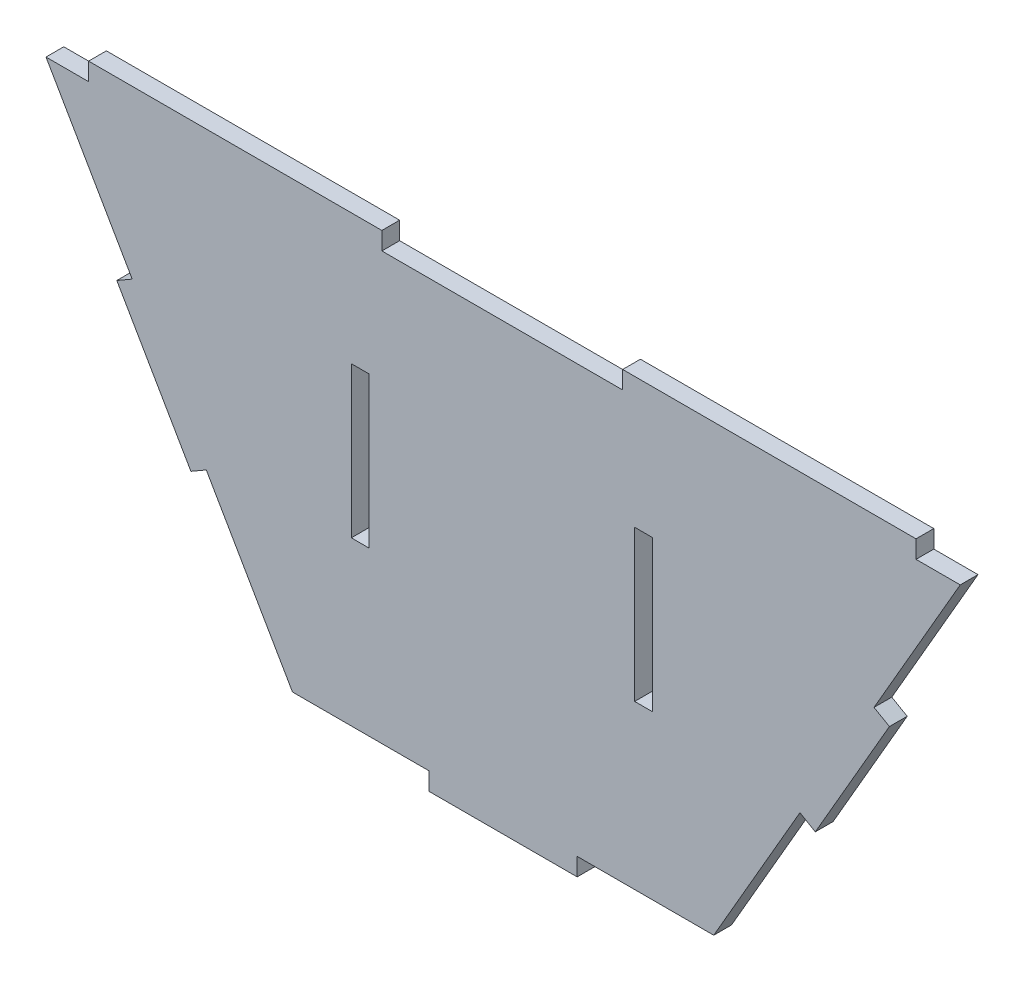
SolidWorks part; units mm, degrees
ref_plane "Front Plane" through (0, 0, 0) normal (0, 0, 1) x (1, 0, 0)
ref_plane "Top Plane" through (0, 0, 0) normal (0, 1, 0) x (1, 0, 0)
ref_plane "Right Plane" through (0, 0, 0) normal (1, 0, 0) x (0, 0, -1)
sketch "Sketch1" plane through (0, 0, 0) normal (0, 0, 1) x (1, 0, 0)
  line L0 (-35.5427, 0) -> (-35.5427, 1.524)
  line L1 (-35.5427, 1.524) -> (-10.3967, 1.524)
  line L2 (-39.1955, 0) -> (-31.8042, -12.7942)
  line L4 (-35.5427, 0) -> (-39.1955, 0)
  line L5 (-13.0154, -22.6139) -> (-11.4914, -22.6139)
  line L6 (-10.3967, 1.524) -> (-10.3967, 0)
  line L7 (-10.3967, 0) -> (10.2512, 0)
  line L8 (10.2512, 0) -> (10.2512, 1.524)
  line L9 (-13.0154, -22.6139) -> (-13.0154, -9.68)
  line L10 (-13.0154, -9.68) -> (-11.4914, -9.68)
  line L11 (10.2512, 1.524) -> (35.4052, 1.524)
  line L12 (0, 0) -> (0, 32.8386) construction
  line L13 (35.4052, 0) -> (39.1955, 0)
  line L14 (39.1955, 0) -> (31.8042, -12.7942)
  line L15 (35.4052, 0) -> (35.4052, 1.524)
  line L16 (-18.0601, -36.5852) -> (-6.35, -36.5852)
  line L17 (-25.4513, -23.791) -> (-18.0601, -36.5852)
  line L18 (25.4513, -23.791) -> (18.0601, -36.5852)
  line L19 (-31.8042, -12.7942) -> (-33.1239, -13.5565)
  line L20 (25.4513, -23.791) -> (26.7709, -24.5533)
  line L21 (-25.4513, -23.791) -> (-26.7709, -24.5533)
  line L22 (31.8042, -12.7942) -> (33.1239, -13.5565)
  line L23 (6.35, -36.5852) -> (18.0601, -36.5852)
  line L24 (-33.1239, -13.5565) -> (-26.7709, -24.5533)
  line L25 (-6.35, -36.5852) -> (-6.35, -38.1092)
  line L26 (26.7709, -24.5533) -> (33.1239, -13.5565)
  line L27 (6.35, -36.5852) -> (6.35, -38.1092)
  line L28 (-11.4914, -22.6139) -> (-11.4914, -9.68)
  line L29 (-6.35, -38.1092) -> (6.35, -38.1092)
  line L30 (11.2793, -22.6139) -> (11.2793, -9.68)
  line L31 (12.8033, -9.68) -> (11.2793, -9.68)
  line L32 (12.8033, -22.6139) -> (12.8033, -9.68)
  line L33 (12.8033, -22.6139) -> (11.2793, -22.6139)
extrude "Boss-Extrude1" add sketch "Sketch1" along normal blind 1.524
